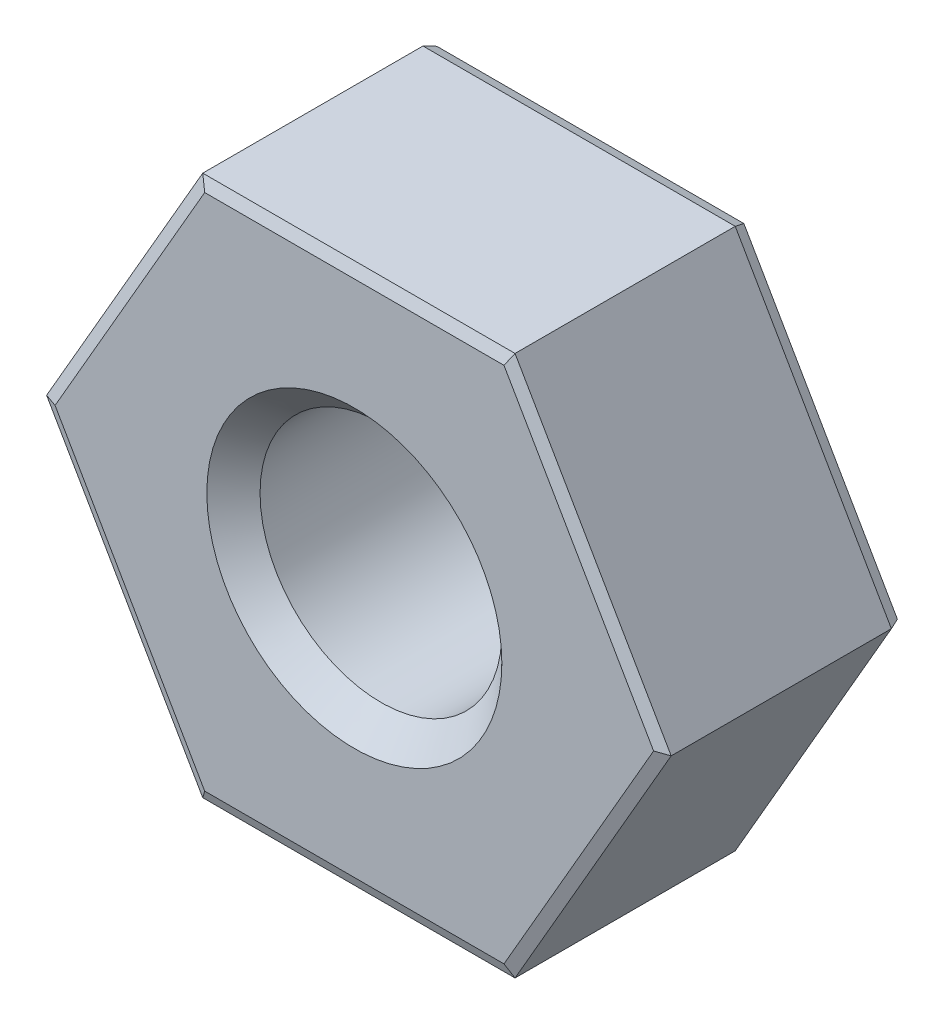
SolidWorks part; units mm, degrees
ref_plane "Alzado" through (0, 0, 0) normal (0, 0, 1) x (1, 0, 0)
ref_plane "Planta" through (0, 0, 0) normal (0, 1, 0) x (1, 0, 0)
ref_plane "Vista lateral" through (0, 0, 0) normal (1, 0, 0) x (0, 0, -1)
ref_plane "Plano1" through (0, 0, 0) normal (0, 0, -1) x (-1, 0, 0)
sketch "Croquis1" plane through (0, 0, 0) normal (0, 0, -1) x (-1, 0, 0)
  line L0 (-3.1754, 0) -> (-1.5877, -2.75)
  line L1 (-1.5877, -2.75) -> (1.5877, -2.75)
  line L2 (1.5877, -2.75) -> (3.1754, 0)
  line L3 (3.1754, 0) -> (1.5877, 2.75)
  line L4 (1.5877, 2.75) -> (-1.5877, 2.75)
  line L5 (-1.5877, 2.75) -> (-3.1754, 0)
extrude "Saliente-Extruir1" add sketch "Croquis1" against normal blind 2.4
hole_wizard "Taladro de margen para M21" positions "Croquis3" profile "Croquis2" hole size "M2" standard "Ansi Metric"
sketch "Croquis3" plane through (0, 0, 2.4) normal (0, 0, 1) x (1, 0, 0)
  point P0 (0, 0)
sketch "Croquis2" plane through (0, 0, 2.4) normal (1, 0, 0) x (0, -1, 0)
  line L0 (0, 0) -> (0, 2.4)
  line L1 (0, 2.4) -> (1.2294, 2.4)
  line L2 (1.2294, 2.4) -> (1.2294, 0)
  line L5 (1.2294, 0) -> (0, 0)
  line L11 (0, -6.35) -> (0, 107.95) construction
  dimension "Diámetro de taladro hasta el siguiente" = 2.4588
  dimension "Profundidad de taladro hasta el siguiente" = 2.4
chamfer "Chaflán1" distance 0.2706 angle 45 2 edges at (1.2294, 0, 0) (1.2294, 0, 2.4)
chamfer "Chaflán2" distance 0.1146 angle 22 12 edges at (2.3816, 1.375, 0) (0, 2.75, 0) (-2.3816, 1.375, 0) (-2.3816, -1.375, 0) (0, -2.75, 0) (2.3816, -1.375, 0) (0, -2.75, 2.4) (-2.3816, -1.375, 2.4) (-2.3816, 1.375, 2.4) (0, 2.75, 2.4) (2.3816, 1.375, 2.4) (2.3816, -1.375, 2.4)
